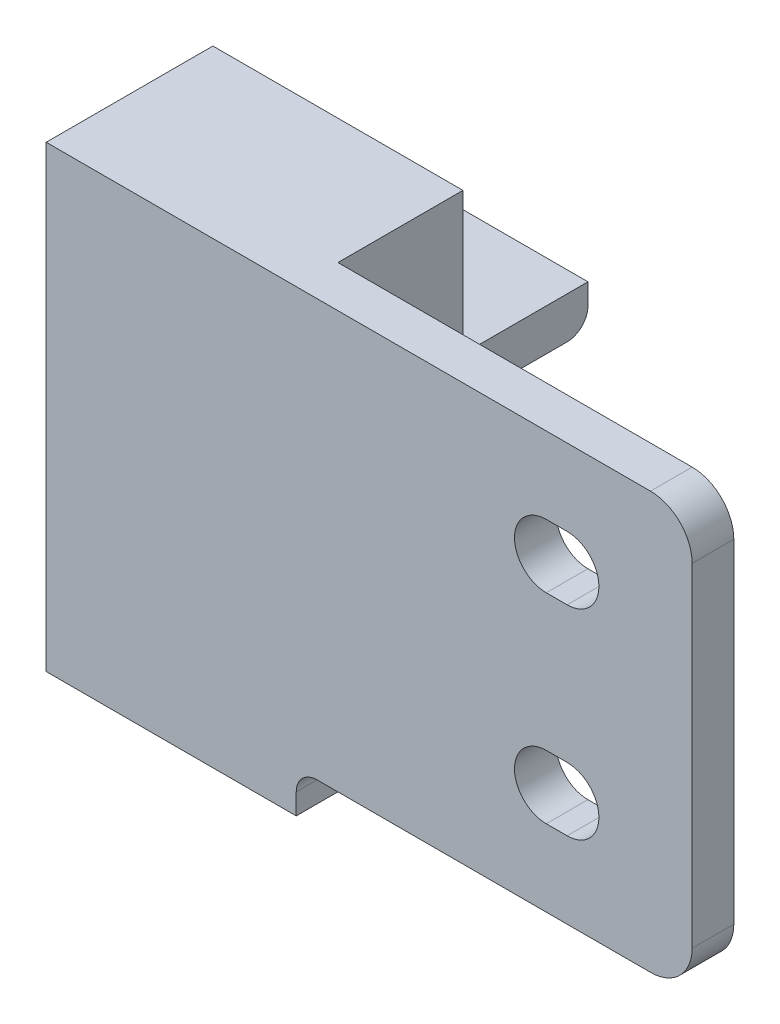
SolidWorks part; units mm, degrees
ref_plane "Plan de face" through (0, 0, 0) normal (0, 0, 1) x (1, 0, 0)
ref_plane "Plan de dessus" through (0, 0, 0) normal (0, 1, 0) x (1, 0, 0)
ref_plane "Plan de droite" through (0, 0, 0) normal (1, 0, 0) x (0, 0, -1)
sketch "Esquisse1" plane through (0, 0, 0) normal (0, 0, 1) x (1, 0, 0)
  line L0 (-30.5, 10) -> (0.5, 10)
  line L1 (-6.5, -4.8) -> (-5.5, -4.8) construction
  line L2 (-6.5, -3.275) -> (-5.5, -3.275)
  line L3 (-6.5, 4.8) -> (-5.5, 4.8) construction
  line L4 (-6.5, 6.325) -> (-5.5, 6.325)
  line L5 (-6.5, 3.275) -> (-5.5, 3.275)
  line L6 (0.5, 0) -> (-6, 0) construction
  line L7 (-6.5, 4.8) -> (-30.5, 4.8) construction
  line L10 (-6.5, -4.8) -> (-5.5, -4.8) construction
  line L11 (-6.5, -6.325) -> (-5.5, -6.325)
  line L12 (0.5, 10) -> (0.5, -10)
  line L13 (-6, 0) -> (-6, 4.8) construction
  line L14 (0.5, 10) -> (0.5, -10) construction
  line L15 (0.5, -10) -> (-30.5, -10)
  line L16 (-30.5, 10) -> (-30.5, -10)
  arc A0 (-6.5, 6.325) -> (-6.5, 3.275) centre (-6.5, 4.8) ccw
  circle A1 centre (-6, 4.8) radius 1.5 construction
  circle A2 centre (-6, -4.8) radius 1.5 construction
  arc A3 (-5.5, 3.275) -> (-5.5, 6.325) centre (-5.5, 4.8) ccw
  arc A4 (-6.5, -3.275) -> (-6.5, -6.325) centre (-6.5, -4.8) ccw
  arc A5 (-5.5, -6.325) -> (-5.5, -3.275) centre (-5.5, -4.8) ccw
  point P0 (-6, 4.8)
  point P11 (-6, -4.8)
extrude "Boss.-Extru.1" add sketch "Esquisse1" along normal blind 2
sketch "Esquisse3" plane through (0, 0, 0) normal (0, 0, 1) x (1, 0, 0)
  line L0 (-30.5, -10) -> (0.5, -10) construction
  line L1 (-30.5, 10) -> (-20.5, 10)
  line L2 (-30.5, 10) -> (-30.5, -10)
  line L3 (-30.5, -10) -> (-20.5, -10)
  line L6 (0.5, 10) -> (-30.5, 10) construction
  line L7 (-20.5, 10) -> (-18.5, 10)
  line L9 (-20.5, -10) -> (-18.5, -10)
  line L10 (-18.5, 10) -> (-18.5, -10)
extrude "Boss.-Extru.2" add sketch "Esquisse3" against normal blind 6
fillet "Congé1" [suppressed] radius 1
fillet "Congé2" radius 2 2 edges at (0.5, -10, 1) (0.5, 10, 1)
sketch "Esquisse5" plane through (0, 0, 0) normal (0, 0, 1) x (1, 0, 0)
  line L0 (-18.5, -10) -> (-18.5, 10) construction
  line L1 (-30.5, -10) -> (-18.5, -10) construction
  line L2 (-30.5, -10) -> (-30.5, 1.2) construction
  line L3 (-30.5, 1.2) -> (-18.5, 1.2) construction
  line L4 (-18.5, -10) -> (-18.5, 1.2) construction
  line L5 (-30.5, -10) -> (-18.5, -10)
  line L6 (-30.5, -10) -> (-30.5, -12)
  line L7 (-30.5, -12) -> (-18.5, -12)
  line L8 (-18.5, -10) -> (-18.5, -12)
  line L9 (-30.5, 1.2) -> (-18.5, 1.2)
  line L10 (-30.5, 1.2) -> (-30.5, 3.2)
  line L11 (-30.5, 3.2) -> (-18.5, 3.2)
  line L12 (-18.5, 1.2) -> (-18.5, 3.2)
extrude "Boss.-Extru.3" add sketch "Esquisse5" along normal blind 2 and the other way blind 12
fillet "Congé3" radius 1 3 edges at (-24.5, -10, -12) (-24.5, 1.2, -12) (-18.5, -10, 1)
